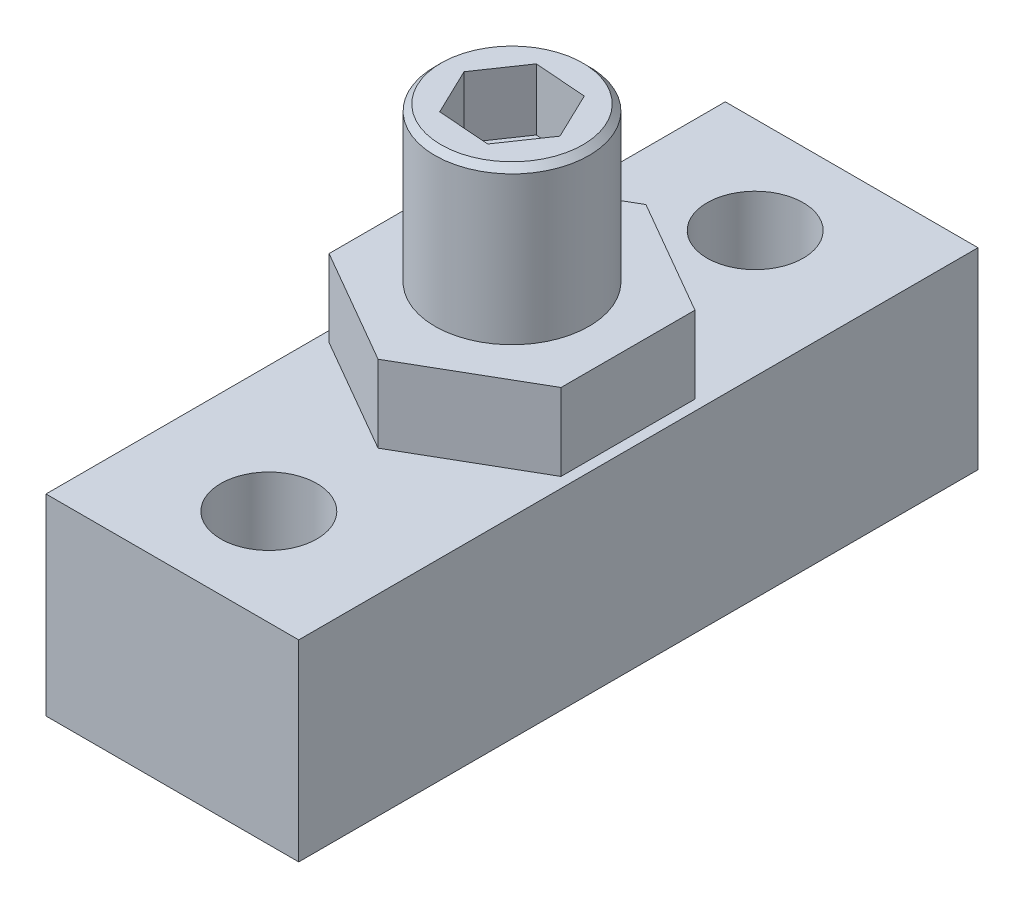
SolidWorks part; units mm, degrees
ref_plane "Front/Back" through (0, 0, 0) normal (0, 0, 1) x (1, 0, 0)
ref_plane "Top/Bottom" through (0, 0, 0) normal (0, 1, 0) x (1, 0, 0)
ref_plane "Right/Left" through (0, 0, 0) normal (1, 0, 0) x (0, 0, -1)
sketch "Sketch1" plane through (0, 0, 0) normal (0, 1, 0) x (1, 0, 0)
  line L0 (0, 0) -> (5.207, 0) construction
  line L1 (-5.207, 13.9954) -> (5.207, 13.9954)
  line L2 (-5.207, 13.9954) -> (-5.207, -13.9954)
  line L3 (-5.207, -13.9954) -> (5.207, -13.9954)
  line L4 (5.207, 13.9954) -> (5.207, -13.9954)
  line L5 (0, 0) -> (0, 13.9954) construction
  dimension "D1" = 10.414
  dimension "D2" = 27.9908
extrude "Extrude1" add sketch "Sketch1" along normal mid plane 7.9248
sketch "Sketch2" plane through (0, 3.9624, 0) normal (0, 1, 0) x (-1, 0, 0)
  line L0 (0, 0) -> (0, 15.2034) construction
  line L1 (0, 0) -> (6.5129, 0) construction
  circle A0 centre (0, 10.0203) radius 1.9812
  circle A1 centre (0, -10.0203) radius 1.9812
  dimension "D1" = 20.0406
  dimension "D2" = 3.9624
extrude "Cut-Extrude1" cut sketch "Sketch2" against normal through all
sketch "Sketch3" plane through (0, 3.9624, 0) normal (0, 1, 0) x (-1, 0, 0)
  line L1 (0, 5.5186) -> (-4.7792, 2.7593)
  line L2 (-4.7792, 2.7593) -> (-4.7792, -2.7593)
  line L3 (-4.7792, -2.7593) -> (0, -5.5186)
  line L4 (0, -5.5186) -> (4.7792, -2.7593)
  line L5 (4.7792, -2.7593) -> (4.7792, 2.7593)
  line L6 (4.7792, 2.7593) -> (0, 5.5186)
  circle A0 centre (0, 0) radius 4.7792 construction
extrude "Extrude2" add sketch "Sketch3" along normal blind 3.175
sketch "Sketch4" plane through (0, 7.1374, 0) normal (0, 1, 0) x (-1, 0, 0)
  circle A0 centre (0, 0) radius 3.175
  dimension "D1" = 6.35
extrude "Extrude3" add sketch "Sketch4" along normal blind 6.35
sketch "Sketch5" plane through (0, 13.4874, 0) normal (0, 1, 0) x (-1, 0, 0)
  line L1 (1.2085, 1.7702) -> (-0.9288, 1.9317)
  line L2 (-0.9288, 1.9317) -> (-2.1373, 0.1615)
  line L3 (-2.1373, 0.1615) -> (-1.2085, -1.7702)
  line L4 (-1.2085, -1.7702) -> (0.9288, -1.9317)
  line L5 (0.9288, -1.9317) -> (2.1373, -0.1615)
  line L6 (2.1373, -0.1615) -> (1.2085, 1.7702)
  circle A0 centre (0, 0) radius 1.8562 construction
extrude "Cut-Extrude2" cut sketch "Sketch5" against normal blind 2.54
chamfer "Chamfer1" distance 0.254 angle 45
